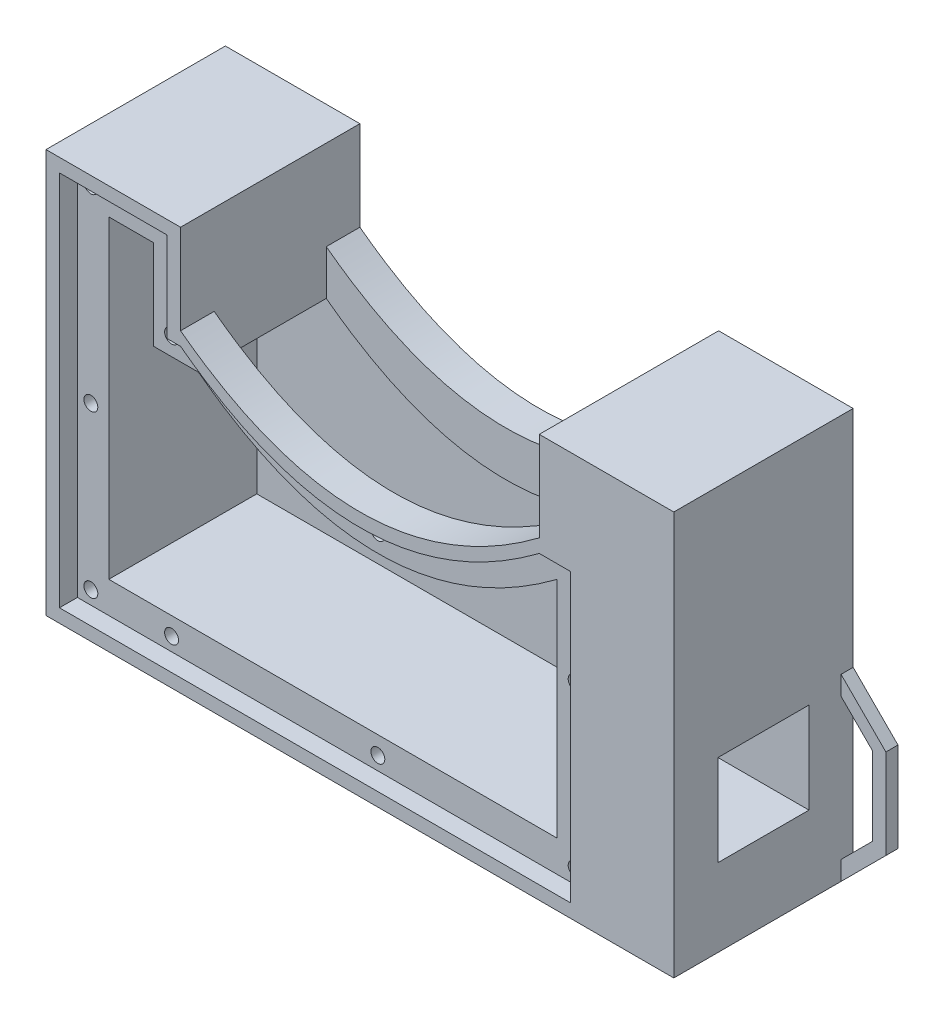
SolidWorks part; units mm, degrees
ref_plane "前视基准面" through (0, 0, 0) normal (0, 0, 1) x (1, 0, 0)
ref_plane "上视基准面" through (0, 0, 0) normal (0, 1, 0) x (1, 0, 0)
ref_plane "右视基准面" through (0, 0, 0) normal (1, 0, 0) x (0, 0, -1)
sketch "草图1" plane through (0, 0, 0) normal (0, 0, 1) x (1, 0, 0)
  line L0 (-61.3776, 0) -> (75.6888, 0) construction
  line L1 (0, 39.6046) -> (0, -40.7526) construction
  line L2 (30, 90) -> (0, 90)
  line L3 (0, 90) -> (0, 0)
  line L4 (0, 0) -> (140, 0)
  line L5 (140, 0) -> (140, 90)
  line L6 (140, 90) -> (110, 90)
  line L7 (110, 90) -> (110, 70)
  line L8 (30, 90) -> (30, 70)
  line L9 (70, 0) -> (70, 143.819) construction
  spline S0 degree 2 poles (30, 70) (70, 40) (110, 70) knots 0 0 0 1 1 1
  dimension "D1" = 30
  dimension "D2" = 30
  dimension "D3" = 140
  dimension "D4" = 20
  dimension "D5" = 20
  dimension "D6" = 90
  dimension "D7" = 90
  dimension "D8" = 15
extrude "凸台-拉伸1" add sketch "草图1" along normal blind 40
sketch "草图2" plane through (0, 0, 40) normal (0, 0, 1) x (1, 0, 0)
  line L0 (30, 90) -> (30, -7.0935) construction
  line L1 (110, 90) -> (110, -7.0935) construction
  line L2 (10, 80) -> (10, 10)
  line L3 (10, 10) -> (110, 10)
  line L4 (110, 10) -> (110, 60)
  line L5 (10, 80) -> (20, 80)
  line L6 (20, 80) -> (20, 60)
  line L7 (70, 0) -> (70, 81.4228) construction
  line L8 (0, 0) -> (140, 0) construction
  line L9 (20, 60) -> (30, 60)
  line L10 (0, 90) -> (0, 0) construction
  line L11 (30, 90) -> (0, 90) construction
  spline S0 degree 2 poles (30, 60) (70, 30) (110, 60) knots 0 0 0 1 1 1
  dimension "D1" = 10
  dimension "D2" = 10
  dimension "D3" = 10
  dimension "D4" = 10
  dimension "D5" = 15
  dimension "D6" = 10
  dimension "D7" = 10
extrude "切除-拉伸2" cut sketch "草图2" against normal blind 37
sketch "草图4" plane through (140, 0, 0) normal (1, 0, 0) x (0, 0, -1)
  line L0 (-20, 37.65) -> (-20, -2.0666) construction
  line L1 (-30.15, 37.65) -> (-9.85, 37.65)
  line L2 (-30.15, 37.65) -> (-30.15, 17.35)
  line L3 (-30.15, 17.35) -> (-9.85, 17.35)
  line L4 (-9.85, 37.65) -> (-9.85, 17.35)
  line L5 (0, 0) -> (0, 90) construction
  line L6 (-30.15, 27.5) -> (57.8699, 27.5) construction
  line L7 (-40, 0) -> (0, 0) construction
  dimension "D1" = 20.3
  dimension "D2" = 20.3
  dimension "D3" = 20
  dimension "D4" = 27.5
extrude "切除-拉伸4" cut sketch "草图4" against normal blind 24
sketch "草图5" plane through (116, 0, 0) normal (1, 0, 0) x (0, 0, -1)
  line L0 (-30.15, 27.5) -> (23.9989, 27.5) construction
  line L1 (-30.15, 37.65) -> (-30.15, 17.35) construction
  line L2 (-20, 37.65) -> (-20, -2.7439) construction
  line L3 (-9.85, 37.65) -> (-30.15, 37.65) construction
  circle A0 centre (-20, 27.5) radius 8.05
  dimension "D1" = 16.1
extrude "切除-拉伸5" cut sketch "草图5" against normal blind 1.7
sketch "草图6" plane through (114.3, 0, 0) normal (1, 0, 0) x (0, 0, -1)
  line L0 (-30.15, 27.5) -> (23.0377, 27.5) construction
  line L1 (-30.15, 37.65) -> (-30.15, 17.35) construction
  line L2 (-20, 37.65) -> (-20, -4.2225) construction
  line L3 (-9.85, 37.65) -> (-30.15, 37.65) construction
  circle A0 centre (-20, 27.5) radius 4
  dimension "D1" = 8
extrude "切除-拉伸6" cut sketch "草图6" against normal blind 4.5
sketch "草图7" plane through (116, 0, 0) normal (1, 0, 0) x (0, 0, -1)
  line L0 (-20, 37.65) -> (-20, 8.7628) construction
  line L1 (-9.85, 37.65) -> (-30.15, 37.65) construction
  line L2 (-30.15, 27.5) -> (5.7089, 27.5) construction
  line L3 (-30.15, 37.65) -> (-30.15, 17.35) construction
  circle A0 centre (-27.923, 35.25) radius 1
  circle A1 centre (-12.423, 35.25) radius 1
  circle A2 centre (-12.423, 19.75) radius 1
  circle A3 centre (-27.923, 19.75) radius 1
  point P0 (-27.923, 35.25)
  point P1 (-27.923, 19.75)
  point P2 (-12.423, 19.75)
  point P3 (-12.423, 35.25)
  dimension "D1" = 2
  dimension "D2" = 15.5
  dimension "D3" = 15.5
  dimension "D4" = 15.5
  dimension "D5" = 15.5
  dimension "D6" = 7.923
  dimension "D7" = 7.75
  dimension "D8" = 7.75
  dimension "D9" = 7.75
extrude "切除-拉伸7" cut sketch "草图7" against normal up to next
sketch "草图8" plane through (0, 0, 0) normal (0, 0, -1) x (-1, 0, 0)
  line L0 (-140, 90) -> (-140, -18.4853) construction
  line L1 (0, 90) -> (0, -11.1693) construction
  line L2 (-140, 40) -> (-150, 30)
  line L3 (-150, 30) -> (-150, 10)
  line L4 (-150, 10) -> (-140, 0)
  line L5 (0, 40) -> (10, 30)
  line L6 (10, 30) -> (10, 10)
  line L7 (10, 10) -> (0, 0)
  line L8 (-140, 35.7574) -> (-147, 28.7574)
  line L9 (-147, 28.7574) -> (-147, 11.2426)
  line L10 (-140, 0) -> (-140, 90) construction
  line L11 (-147, 11.2426) -> (-140, 4.2426)
  line L12 (0, 35.7574) -> (7, 28.7574)
  line L13 (7, 28.7574) -> (7, 11.2426)
  line L14 (7, 11.2426) -> (0, 4.2426)
  line L15 (-140, 4.2426) -> (47.5067, 4.2426) construction
  dimension "D1" = 10
  dimension "D2" = 10
  dimension "D3" = 45
  dimension "D4" = 45
  dimension "D5" = 45
  dimension "D6" = 45
  dimension "D7" = 20
  dimension "D8" = 20
  dimension "D9" = 3
  dimension "D10" = 3
  dimension "D11" = 3
  dimension "D12" = 3
  dimension "D13" = 3
extrude "把手" add sketch "草图8" against normal blind 2.7 contours L11 L9 L8 L2 L3 L4 M21 | L13 L14 L7 L6 L5 L12 M23
sketch "草图9" plane through (0, 0, 40) normal (0, 0, 1) x (1, 0, 0)
  line L0 (30, 67) -> (27, 67)
  line L1 (27, 67) -> (27, 87)
  line L2 (27, 87) -> (3, 87)
  line L3 (3, 87) -> (3, 3)
  line L4 (3, 3) -> (117, 3)
  line L5 (117, 3) -> (117, 67)
  line L6 (70, 0) -> (70, 113.9125) construction
  line L7 (0, 0) -> (140, 0) construction
  line L8 (30, 90) -> (30, -5.3785) construction
  line L9 (110, 90) -> (110, -17.4) construction
  line L10 (117, 67) -> (110, 67)
  line L11 (0, 90) -> (0, 0) construction
  line L12 (30, 90) -> (0, 90) construction
  parabola Q0 construction
  spline S0 degree 2 poles (30, 67) (70, 37) (110, 67) knots 0 0 0 1 1 1
  point P13 (70, 45)
  dimension "D1" = 3
  dimension "D2" = 3
  dimension "D3" = 3
  dimension "D4" = 3
  dimension "D5" = 7
  dimension "D6" = 3
  dimension "D7" = 15
  dimension "D8" = 3
extrude "盖子" cut sketch "草图9" against normal blind 4
sketch "草图11" plane through (0, 0, 36) normal (0, 0, 1) x (1, 0, 0)
  line L0 (6, 95.1534) -> (6, -11.1534) construction
  line L1 (114, 97.432) -> (114, -12.2166) construction
  line L2 (-20.7438, 6) -> (194.832, 6) construction
  line L3 (-10.6428, 84) -> (49.4313, 84) construction
  line L4 (24, 98.2294) -> (24, -17.9317) construction
  line L5 (3, 87) -> (3, 3) construction
  line L6 (27, 87) -> (3, 87) construction
  line L7 (27, 67) -> (27, 87) construction
  line L8 (3, 3) -> (117, 3) construction
  line L9 (117, 3) -> (117, 67) construction
  line L10 (70, 0) -> (70, 111.3872) construction
  line L11 (0, 0) -> (140, 0) construction
  circle A0 centre (6, 84) radius 1.55
  circle A1 centre (24, 84) radius 1.55
  circle A2 centre (6, 42) radius 1.55
  circle A3 centre (6, 6) radius 1.55
  circle A4 centre (114, 6) radius 1.55
  circle A5 centre (114, 42) radius 1.55
  circle A6 centre (24, 64) radius 1.55
  circle A7 centre (114, 64) radius 1.55
  circle A9 centre (70, 6) radius 1.55
  circle A10 centre (24, 6) radius 1.55
  dimension "D6" = 3.1
  dimension "D7" = 3.1
  dimension "D8" = 3.1
  dimension "D9" = 3.1
  dimension "D10" = 3.1
  dimension "D11" = 3.1
  dimension "D12" = 3.1
  dimension "D13" = 3.1
  dimension "D14" = 3.1
  dimension "D16" = 3.1
  dimension "D1" = 3
  dimension "D2" = 3
  dimension "D3" = 3
  dimension "D4" = 3
  dimension "D5" = 3
  dimension "D17" = 42
  dimension "D19" = 20
extrude "螺丝口" cut sketch "草图11" against normal blind 4
sketch "草图12" plane through (0, 90, 0) normal (0, 1, 0) x (1, 0, 0)
  line L0 (140, -20) -> (-38.9521, -20) construction
  line L1 (140, -40) -> (140, 0) construction
  line L2 (70, 0) -> (70, -77.5287) construction
  line L3 (30, -7.5) -> (110, -7.5)
  line L4 (30, -7.5) -> (30, -32.5)
  line L5 (30, -32.5) -> (110, -32.5)
  line L6 (110, -7.5) -> (110, -32.5)
  line L7 (110, 0) -> (30, 0) construction
  dimension "D1" = 25
  dimension "D2" = 80
  dimension "D3" = 12.5
  dimension "D4" = 40
extrude "切除-probe window" cut sketch "草图12" against normal up to next
sketch "草图13" plane through (0, 0, 3) normal (0, 0, 1) x (1, 0, 0)
  line L0 (15, 80) -> (15, -24.577) construction
  line L1 (20, 80) -> (10, 80) construction
  circle A0 centre (15, 75) radius 2.5
  dimension "D1" = 5
  dimension "D2" = 5
extrude "切除-注水口" cut sketch "草图13" against normal up to next
sketch "草图14" plane through (0, 0, 36) normal (0, 0, 1) x (1, 0, 0)
  line L0 (70, 0) -> (70, 82.7005) construction
  line L1 (0, 0) -> (140, 0) construction
  line L2 (24, 64) -> (114, 64) construction
  circle A0 centre (70, 49) radius 1.55
  dimension "D1" = 3.1
  dimension "D2" = 15
extrude "切除-拉伸12" cut sketch "草图14" against normal blind 3
